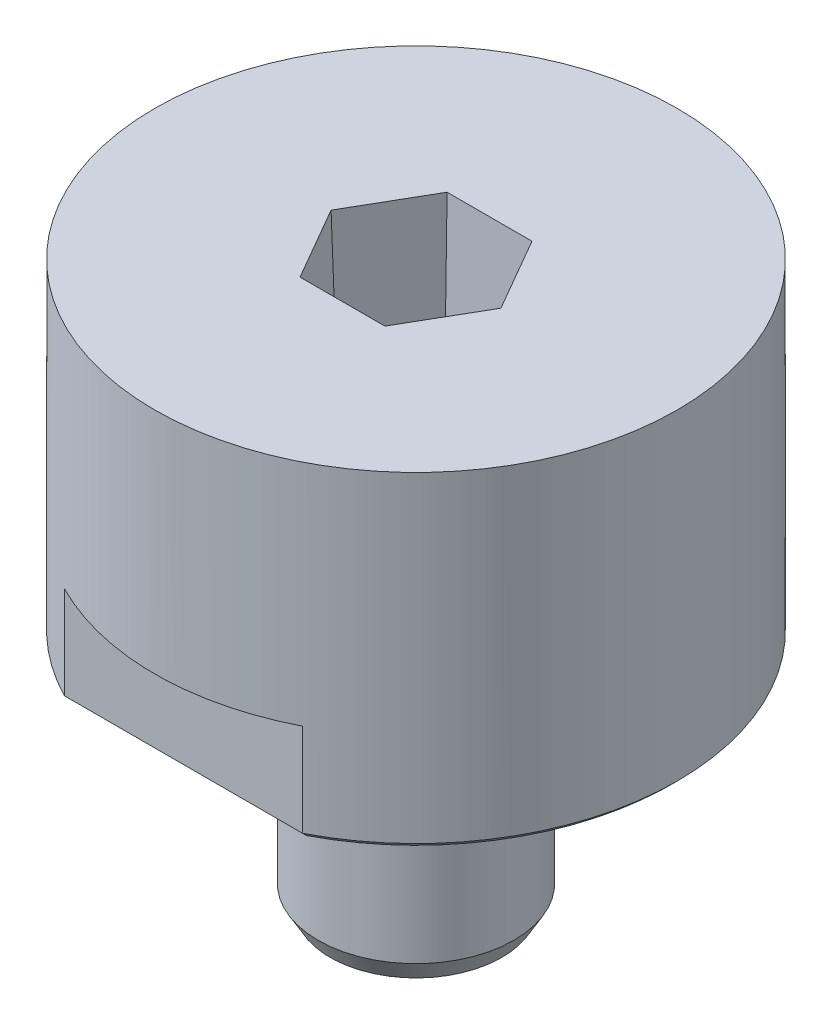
SolidWorks part; units mm, degrees
ref_plane "Front Plane" through (0, 0, 0) normal (0, 0, 1) x (1, 0, 0)
ref_plane "Top Plane" through (0, 0, 0) normal (0, 1, 0) x (1, 0, 0)
ref_plane "Right Plane" through (0, 0, 0) normal (1, 0, 0) x (0, 0, -1)
sketch "Sketch1" plane through (0, 0, 0) normal (0, 0, 1) x (1, 0, 0)
  line L0 (0, 0) -> (0, 27.305) construction
  line L1 (0, 0) -> (4.1759, 0)
  line L3 (5.5245, 11.43) -> (12.6975, 11.43)
  line L4 (12.6975, 11.43) -> (12.6975, 27.305)
  line L5 (12.6975, 27.305) -> (0, 27.305)
  line L6 (0, 27.305) -> (0, 0)
  line L9 (4.7625, 7.5692) -> (4.4577, 7.5692)
  line L10 (4.4577, 7.5692) -> (4.4577, 7.112)
  line L11 (4.4577, 7.112) -> (4.7625, 7.112)
  line L12 (4.7625, 7.5692) -> (4.7625, 10.668)
  line L15 (4.7625, 7.112) -> (4.7625, 1.016)
  line L17 (4.7625, 1.016) -> (4.1759, 0)
  arc A0 (4.7625, 10.668) -> (5.5245, 11.43) centre (5.5245, 10.668) cw
  point P7 (0, 0)
  point P21 (4.7625, 0)
  dimension "D12" = 0.762
  dimension "D2" = 8.9154
  dimension "D3" = 3.8608
  dimension "D4" = 0.4572
  dimension "D5" = 11.43
  dimension "D7" = 1.016
  dimension "D6" = 15.875
  dimension "D9" = 30
  dimension "D11" = 25.3949
  dimension "D8" = 9.525
revolve "Revolve1" add sketch "Sketch1" angle 360 about L0
sketch "Sketch2" plane through (0, 11.43, 0) normal (0, -1, 0) x (1, 0, 0)
  line L0 (-5.7851, 11.303) -> (5.7851, 11.303)
  line L1 (-5.7851, -11.303) -> (5.7851, -11.303)
  line L2 (-12.6975, 0) -> (12.6975, 0) construction
  arc A0 (-5.7851, -11.303) -> (5.7851, -11.303) centre (0, 0) ccw
  circle A1 centre (0, 0) radius 12.6975 construction
  arc A2 (5.7851, 11.303) -> (-5.7851, 11.303) centre (0, 0) ccw
  circle A3 centre (0, 0) radius 12.6975 construction
  dimension "D1" = 22.606
extrude "Cut-Extrude1" cut sketch "Sketch2" against normal blind 4.7625
sketch "Sketch5" plane through (0, 27.305, 0) normal (0, 1, 0) x (1, 0, 0)
  line L0 (-55, 0) -> (55, 0) construction
  line L1 (1.8331, 3.175) -> (-1.8331, 3.175)
  line L2 (-1.8331, 3.175) -> (-3.6662, 0)
  line L3 (-3.6662, 0) -> (-1.8331, -3.175)
  line L4 (-1.8331, -3.175) -> (1.8331, -3.175)
  line L5 (1.8331, -3.175) -> (3.6662, 0)
  line L6 (3.6662, 0) -> (1.8331, 3.175)
  circle A0 centre (0, 0) radius 3.175 construction
  dimension "D1" = 6.35
extrude "Cut-Extrude3" cut sketch "Sketch5" against normal blind 11.43
ref_plane "Plane1" through (0, 0, 0) normal (0.7071, 0, 0.7071) x (0.7071, 0, -0.7071)
sketch "Sketch3" plane through (0, 0, 0) normal (0.7071, 0, 0.7071) x (0.7071, 0, -0.7071)
  line L0 (9.906, 10.5613) -> (9.906, 11.811) construction
  line L3 (10.8044, 11.43) -> (9.906, 11.43)
  line L4 (-3.9017, 11.43) -> (12.6975, 11.43) construction
  line L5 (9.906, 11.43) -> (9.906, 11.811)
  arc A0 (10.8044, 11.43) -> (9.906, 11.811) centre (9.906, 10.5613) ccw
  dimension "D2" = 1.2497
  dimension "D1" = 9.906
  dimension "D3" = 0.381
revolve "Cut-Revolve1" cut sketch "Sketch3" angle 360 about L0
pattern_circular "CirPattern1" count 8 over 360 about axis through (0, 0, 0) along (0, 1, 0) of "Cut-Revolve1"
chamfer "Chamfer1" distance 0.254 angle 45 4 edges at (0, 11.43, -11.303) (-12.6975, 11.43, 0) (12.6975, 11.43, 0) (0, 11.43, 11.303)
draft "Draft3" type of draft neutral plane draft angle 2 faces to draft 6 parameters "D1"=2
sketch "Sketch6" plane through (0, 0, 0) normal (0, 0, 1) x (1, 0, 0)
  line L0 (-4.6718, 7.5692) -> (-5.0482, 7.5692)
  line L1 (-4.7625, 7.5692) -> (4.7625, 7.5692) construction
  line L2 (-5.1752, 7.4422) -> (-5.1752, 7.239)
  line L3 (-5.0482, 7.112) -> (-4.6718, 7.112)
  line L4 (4.7625, 7.112) -> (-4.7625, 7.112) construction
  line L5 (-4.5448, 7.239) -> (-4.5448, 7.4422)
  line L6 (0, 9.5525) -> (0, -0.3907) construction
  arc A0 (-5.1752, 7.239) -> (-5.0482, 7.112) centre (-5.0482, 7.239) ccw
  arc A1 (-4.6718, 7.112) -> (-4.5448, 7.239) centre (-4.6718, 7.239) ccw
  arc A2 (-5.0482, 7.5692) -> (-5.1752, 7.4422) centre (-5.0482, 7.4422) ccw
  arc A3 (-4.6718, 7.5692) -> (-4.5448, 7.4422) centre (-4.6718, 7.4422) cw
  point P15 (-4.5448, 7.112)
  point P20 (-4.5448, 7.5692)
  dimension "D1" = 0.127
revolve "Revolve2" add sketch "Sketch6" angle 360 about L6
